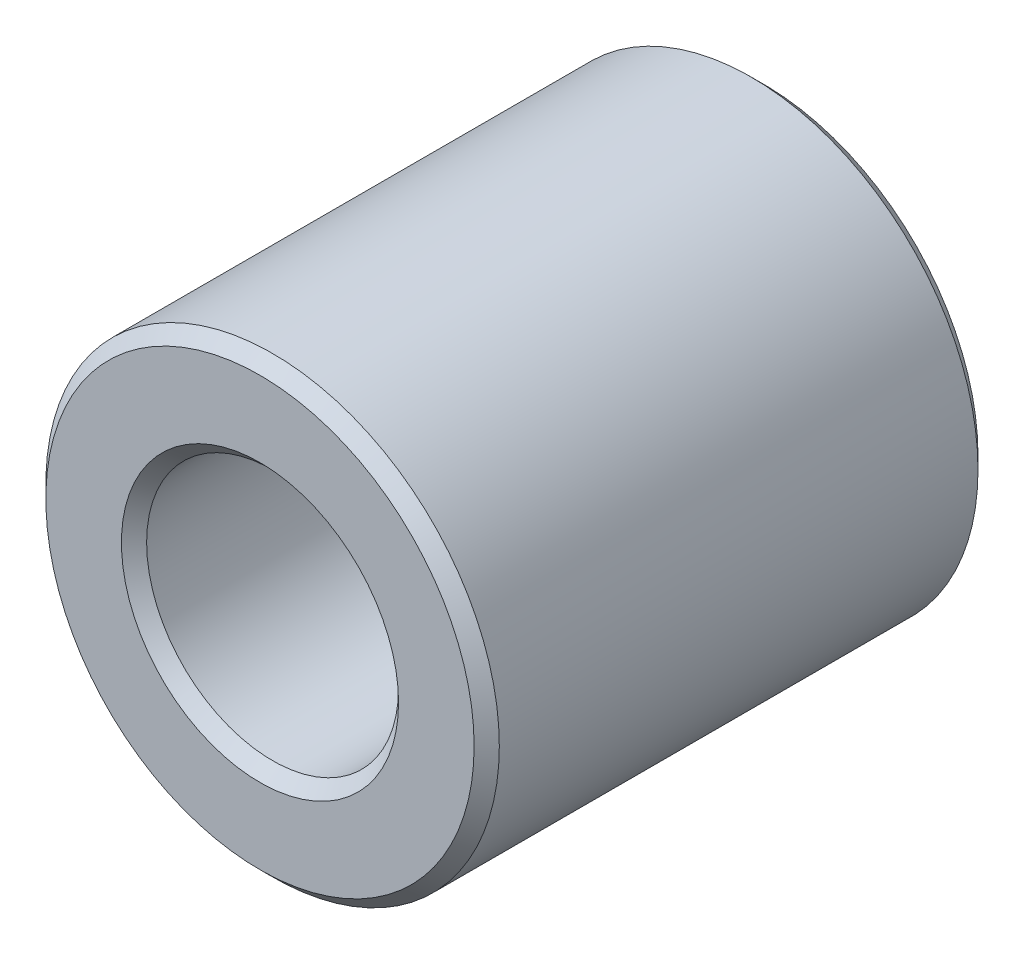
SolidWorks part; units mm, degrees
ref_plane "Front Plane" through (0, 0, 0) normal (0, 0, 1) x (1, 0, 0)
ref_plane "Top Plane" through (0, 0, 0) normal (0, 1, 0) x (1, 0, 0)
ref_plane "Right Plane" through (0, 0, 0) normal (1, 0, 0) x (0, 0, -1)
sketch "Sketch1" plane through (0, 0, 0) normal (0, 0, 1) x (1, 0, 0)
  circle A0 centre (0, 0) radius 25
  circle A1 centre (0, 0) radius 45
  dimension "D1" = 50
  dimension "D2" = 90
extrude "Boss-Extrude1" add sketch "Sketch1" along normal mid plane 100
chamfer "Chamfer1" distance 2.5 angle 45 4 edges at (25, 0, -50) (45, 0, -50) (25, 0, 50) (45, 0, 50)
